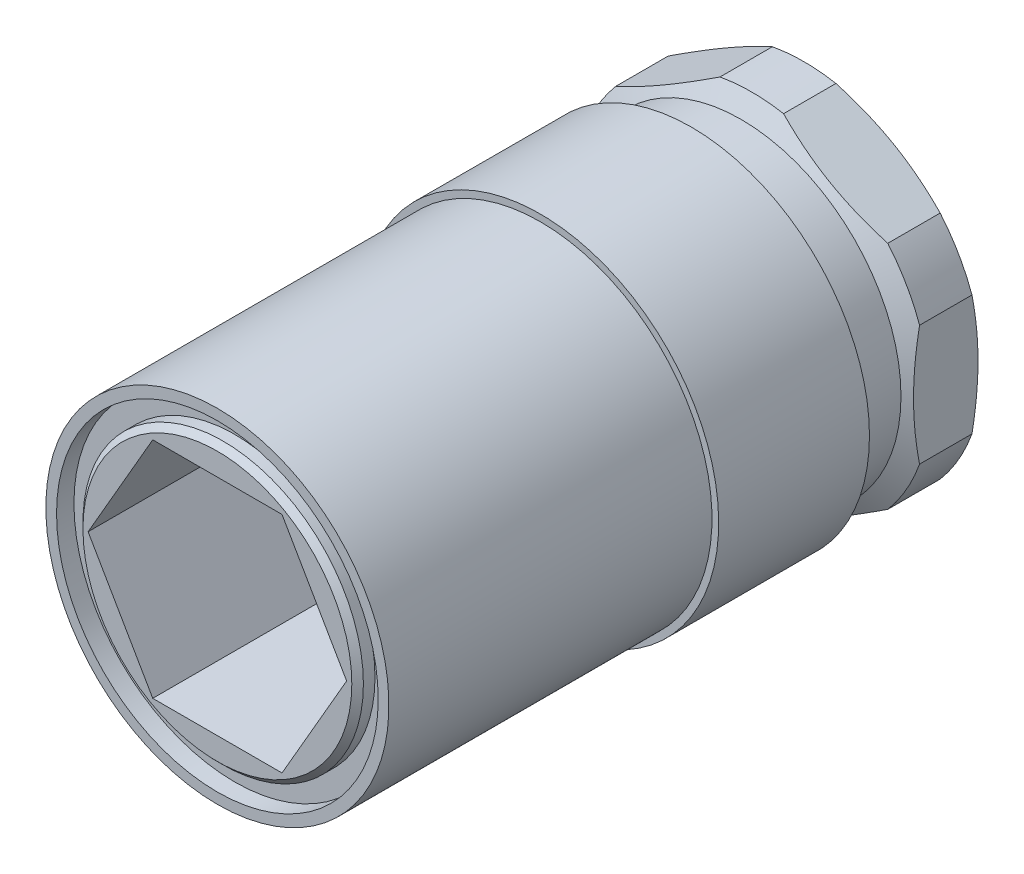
SolidWorks part; units mm, degrees
ref_plane "Front Plane" through (0, 0, 0) normal (0, 0, 1) x (1, 0, 0)
ref_plane "Top Plane" through (0, 0, 0) normal (0, 1, 0) x (1, 0, 0)
ref_plane "Right Plane" through (0, 0, 0) normal (1, 0, 0) x (0, 0, -1)
sketch "Sketch2" plane through (0, 0, 0) normal (0, 0, 1) x (1, 0, 0)
  circle A0 centre (0, 0) radius 15.367
  dimension "D1" = 30.734
extrude "Boss-Extrude1" add sketch "Sketch2" against normal blind 51.5112
sketch "Sketch5" plane through (0, 0, -51.5112) normal (0, 0, -1) x (-1, 0, 0)
  line L1 (-14.4653, -8.3515) -> (0, -16.7031)
  line L2 (0, -16.7031) -> (14.4653, -8.3515)
  line L3 (14.4653, -8.3515) -> (14.4653, 8.3515)
  line L4 (14.4653, 8.3515) -> (0, 16.7031)
  line L5 (0, 16.7031) -> (-14.4653, 8.3515)
  line L6 (-14.4653, 8.3515) -> (-14.4653, -8.3515)
  circle A0 centre (0, 0) radius 14.4653 construction
  dimension "D1" = 28.9306
extrude "Cut-Extrude1" cut sketch "Sketch5" against normal blind 6.35 flip side to cut
sketch "Sketch6" plane through (0, 0, 0) normal (1, 0, 0) x (0, 0, -1)
  line L0 (45.1612, 15.1206) -> (45.1612, 9.9341) construction
  line L1 (45.1612, 13.7795) -> (40.8559, 13.7795)
  line L2 (45.1612, 13.7795) -> (45.1612, 33.7795)
  line L3 (45.1612, 33.7795) -> (40.8559, 33.7795)
  line L4 (40.8559, 13.7795) -> (40.8559, 33.7795)
  line L5 (0, 0) -> (51.5112, 0) construction
  line L6 (51.5112, -5.1865) -> (51.5112, 5.1865) construction
  dimension "D1" = 27.559
  dimension "D2" = 4.3053
  dimension "D3" = 20
revolve "Cut-Revolve1" cut sketch "Sketch6" angle 360 about L5
sketch "Sketch11" plane through (0, 0, 0) normal (0, 0, 1) x (1, 0, 0)
  circle A1 centre (0, 0) radius 12.0904
  circle A2 centre (0, 0) radius 13.867
  circle A3 centre (0, 0) radius 13.867
  dimension "D2" = 24.1808
  dimension "D1" = 1.5
extrude "Cut-Extrude3" cut sketch "Sketch11" against normal blind 1.5
sketch "Sketch12" plane through (0, 0, 0) normal (1, 0, 0) x (0, 0, -1)
  line L0 (45.1612, 17.6606) -> (45.1612, 13.7795)
  line L1 (45.1612, 13.7795) -> (47.4019, 17.6606)
  line L2 (49.2705, 17.6606) -> (51.5112, 17.6606)
  line L3 (45.1612, 15.1206) -> (45.1612, 9.9341) construction
  line L4 (0, 0) -> (51.5112, 0) construction
  line L5 (51.5112, -5.1865) -> (51.5112, 5.1865) construction
  line L11 (51.5112, 13.7795) -> (51.5112, 17.6606)
  line L12 (51.5112, -14.4653) -> (51.5112, 14.4653) construction
  line L13 (45.1612, 17.6606) -> (47.4019, 17.6606)
  line L14 (45.1612, 15.1206) -> (51.5112, 15.1206) construction
  line L17 (49.2705, 17.6606) -> (51.5112, 13.7795)
  dimension "D1" = 13.7795
  dimension "D2" = 30
  dimension "D3" = 30
  dimension "D4" = 2.54
revolve "Cut-Revolve2" cut sketch "Sketch12" angle 360 about L4
sketch "Sketch23" plane through (0, 0, -51.5112) normal (0, 0, -1) x (-1, 0, 0)
  circle A0 centre (0, 0) radius 10.668
  dimension "D1" = 21.336
extrude "Cut-Extrude7" cut sketch "Sketch23" against normal blind 10 draft 3
sketch "Sketch27" plane through (0, 0, 0) normal (1, 0, 0) x (0, 0, -1)
  line L0 (40.8559, -15.367) -> (40.8559, 15.367) construction
  line L1 (0, 15.367) -> (27.8559, 15.367)
  line L2 (0, 15.367) -> (0, 14.7892)
  line L3 (0, 14.7892) -> (27.8559, 14.7892)
  line L4 (27.8559, 15.367) -> (27.8559, 14.7892)
  line L5 (0, 0) -> (40.8559, 0) construction
  line L6 (40.8559, -13.7795) -> (40.8559, 13.7795) construction
  dimension "D1" = 13
  dimension "D2" = 29.5783
revolve "Cut-Revolve5" cut sketch "Sketch27" angle 360 about L5
chamfer "Chamfer5" distance 1 angle 45 1 edges at (-10.668, 0, -51.5112)
chamfer "Chamfer7" distance 0.5 angle 45 1 edges at (12.0904, 0, 0)
sketch "Sketch29" plane through (0, 0, 0) normal (1, 0, 0) x (0, 0, -1)
  line L0 (0, 0) -> (55.1774, 0)
  line L1 (51.5112, -13.7795) -> (51.5112, 13.7795) construction
  line L2 (55.1774, 0) -> (51.5112, 6.35)
  line L3 (27.8559, 9.398) -> (0, 9.398)
  line L4 (0, 14.7892) -> (0, -14.7892) construction
  line L5 (0, 9.398) -> (0, 0)
  line L6 (-3.9478, 0) -> (80.7658, 0) construction
  line L7 (27.8559, 9.398) -> (27.8559, 6.35)
  line L8 (27.8559, 6.35) -> (51.5112, 6.35)
  line L9 (27.8559, 15.367) -> (27.8559, -15.367) construction
  line L11 (51.5112, 10.9093) -> (51.5112, 6.35) construction
  dimension "D1" = 18.796
  dimension "D2" = 60
  dimension "D3" = 12.7
revolve "Cut-Revolve6" cut sketch "Sketch29" angle 360 about L6
sketch "Sketch30" plane through (0, 0, 0) normal (0, 0, 1) x (1, 0, 0)
  line L1 (5.5726, 9.652) -> (-5.5726, 9.652)
  line L2 (-5.5726, 9.652) -> (-11.1452, 0)
  line L3 (-11.1452, 0) -> (-5.5726, -9.652)
  line L4 (-5.5726, -9.652) -> (5.5726, -9.652)
  line L5 (5.5726, -9.652) -> (11.1452, 0)
  line L6 (11.1452, 0) -> (5.5726, 9.652)
  circle A0 centre (0, 0) radius 9.652 construction
  point P1 (-11.2736, 19.9356)
  dimension "D1" = 19.304
extrude "Cut-Extrude8" cut sketch "Sketch30" against normal up to surface (27.8559 mm away)
